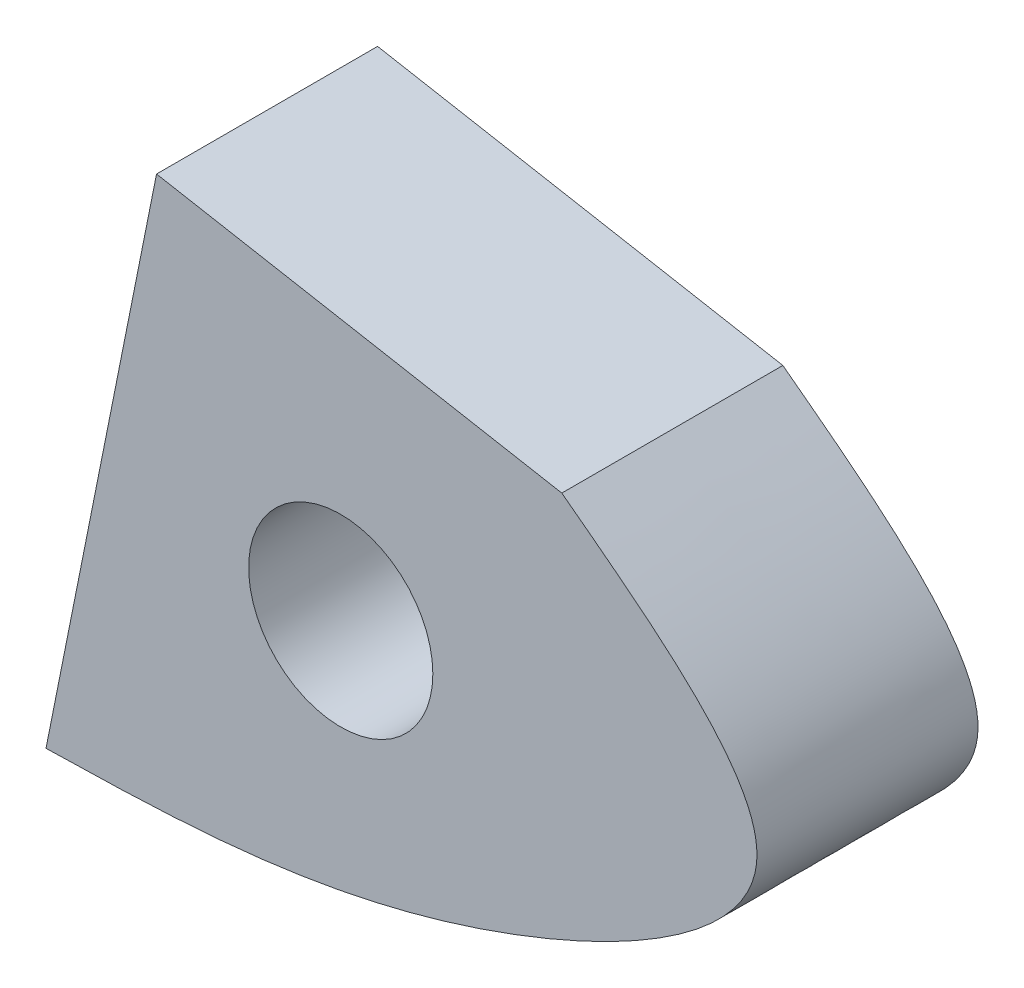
SolidWorks part; units mm, degrees
ref_plane "Front Plane" through (0, 0, 0) normal (0, 0, 1) x (1, 0, 0)
ref_plane "Top Plane" through (0, 0, 0) normal (0, 1, 0) x (1, 0, 0)
ref_plane "Right Plane" through (0, 0, 0) normal (1, 0, 0) x (0, 0, -1)
sketch "Sketch1" plane through (0, 0, 0) normal (0, 0, 1) x (1, 0, 0)
  line L0 (-25, 40) -> (30, 30)
  line L1 (-25, 40) -> (-40, -35)
  circle A0 centre (0, 0) radius 12.5
  point P0 (-25, 40)
  point P1 (30, 30)
  point P2 (56.4575, 0)
  point P3 (20, -26.379)
  point P4 (-40, -35)
  point P7 (20, -26.379)
  point P10 (56.4575, 0)
  dimension "D9" = 25
  dimension "D1" = 55
  dimension "D2" = 30
  dimension "D3" = 40
  dimension "D4" = 45
  dimension "D5" = 60
  dimension "D6" = 75
  dimension "D7" = 40
  dimension "D8" = 30
extrude "Extrude1" add sketch "Sketch1" along normal blind 30
